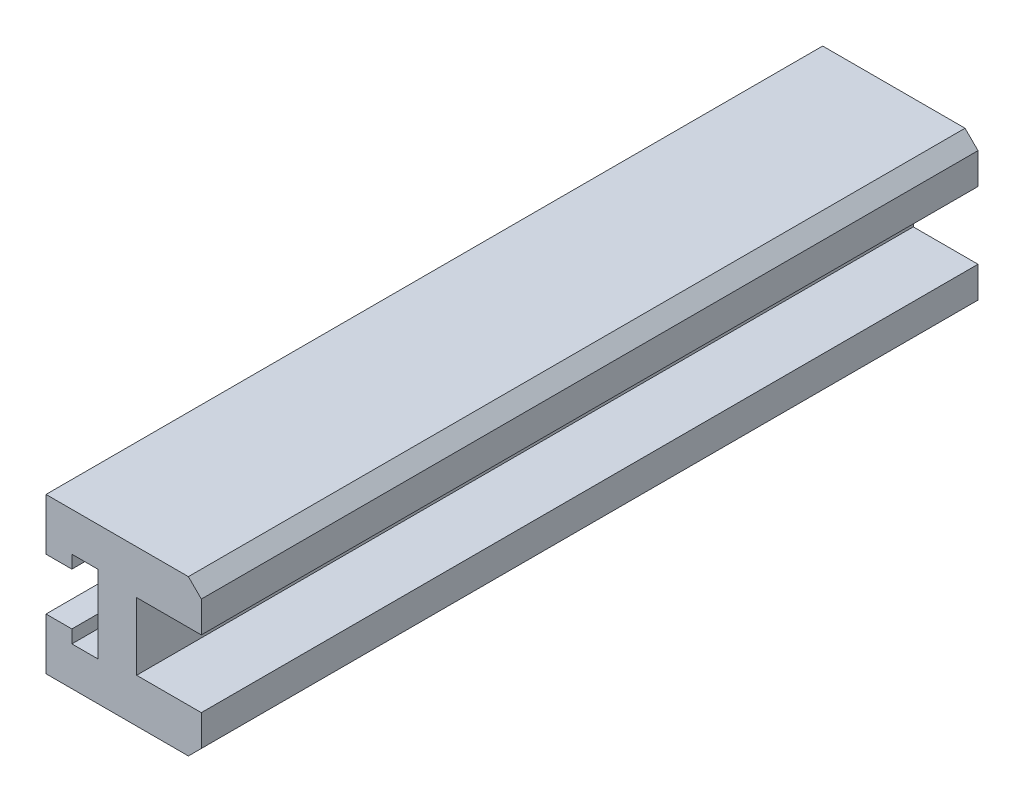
SolidWorks part; units mm, degrees
ref_plane "Front Plane" through (0, 0, 0) normal (0, 0, 1) x (1, 0, 0)
ref_plane "Top Plane" through (0, 0, 0) normal (0, 1, 0) x (1, 0, 0)
ref_plane "Right Plane" through (0, 0, 0) normal (1, 0, 0) x (0, 0, -1)
sketch "Sketch1" plane through (0, 0, 0) normal (0, 0, 1) x (1, 0, 0)
  line L0 (4, 0) -> (-4, 0) construction
  line L1 (-1, -2.6) -> (-1, 2.6)
  line L2 (-1, 2.6) -> (4, 2.6)
  line L3 (4, 0) -> (4, 2.6) construction
  line L4 (4, 2.6) -> (4, 6)
  line L5 (4, 6) -> (-4, 6)
  line L6 (-4, 6) -> (-4, -6)
  line L7 (-1, -2.6) -> (4, -2.6)
  line L8 (4, -2.6) -> (4, -6)
  line L9 (4, -6) -> (-4, -6)
  point P4 (0, 0)
  point P11 (-1, 0)
  dimension "D1" = 3
  dimension "D2" = 8
  dimension "D3" = 2.6
  dimension "D4" = 6
  dimension "D5" = 6
extrude "Boss-Extrude1" add sketch "Sketch1" along normal mid plane 60
sketch "Sketch2" plane through (-1, 0, 0) normal (1, 0, 0) x (0, 0, -1)
  line L0 (0, -6) -> (0, 6) construction
  line L1 (-30, 6) -> (30, 6) construction
  line L2 (0, 0) -> (-30, 0) construction
  line L3 (-30, -2.6) -> (-30, 2.6) construction
  circle A0 centre (-15, 0) radius 1.5
  circle A1 centre (15, 0) radius 1.5
  point P6 (0, 0)
  dimension "D1" = 3
extrude "Cut-Extrude1" cut sketch "Sketch2" against normal through all
chamfer "Chamfer1" distance 1 angle 45 2 edges at (4, 6, 0) (4, -6, 0)
sketch "Sketch3" plane through (0, 0, -30) normal (0, 0, -1) x (-1, 0, 0)
  line L0 (4, 6) -> (8, 6)
  line L1 (0, 0) -> (4, 0) construction
  line L2 (4, 6) -> (4, -6) construction
  line L3 (4, 0) -> (8, 0) construction
  line L4 (8, 6) -> (8, 2)
  line L5 (8, 2) -> (6, 2)
  line L6 (6, 2) -> (6, 3)
  line L7 (6, 3) -> (4, 3)
  line L8 (4, 3) -> (4, 6)
  line L9 (4, -3) -> (4, -6)
  line L10 (6, -3) -> (4, -3)
  line L11 (6, -2) -> (6, -3)
  line L12 (8, -2) -> (6, -2)
  line L13 (8, -6) -> (8, -2)
  line L14 (4, -6) -> (8, -6)
  dimension "D1" = 2
  dimension "D2" = 2
  dimension "D3" = 3
  dimension "D4" = 1
extrude "Boss-Extrude2" add sketch "Sketch3" against normal up to vertex (60 mm away)
